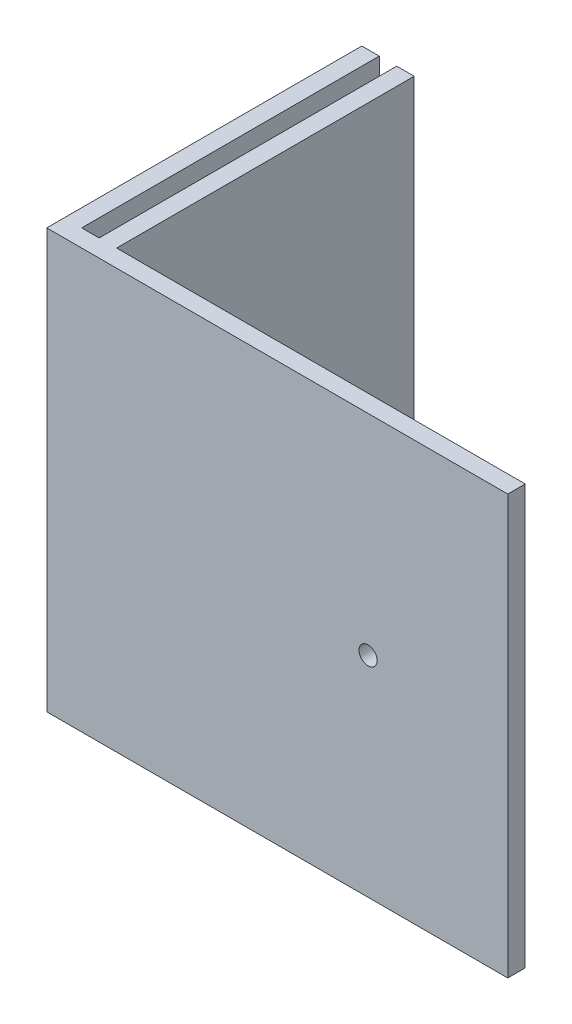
SolidWorks part; units mm, degrees
ref_plane "Front Plane" through (0, 0, 0) normal (0, 0, 1) x (1, 0, 0)
ref_plane "Top Plane" through (0, 0, 0) normal (0, 1, 0) x (1, 0, 0)
ref_plane "Right Plane" through (0, 0, 0) normal (1, 0, 0) x (0, 0, -1)
sketch "Sketch1" plane through (0, 0, 0) normal (0, 0, 1) x (1, 0, 0)
  line L0 (0, 0) -> (0, 76.2)
  line L1 (0, 76.2) -> (-83.82, 76.2)
  line L2 (-83.82, 76.2) -> (-83.82, 0)
  line L3 (-83.82, 0) -> (0, 0)
  circle A0 centre (-25.4, 38.1) radius 1.651
extrude "Boss-Extrude1" add sketch "Sketch1" along normal blind 3.175
sketch "Sketch2" plane through (0, 0, 3.175) normal (0, 0, 1) x (1, 0, 0)
  line L0 (-83.82, 76.2) -> (-80.645, 76.2)
  line L1 (0, 76.2) -> (-83.82, 76.2) construction
  line L2 (-83.82, 76.2) -> (-83.82, 0)
  line L3 (-83.82, 0) -> (-80.645, 0)
  line L4 (-77.47, 0) -> (-74.295, 0)
  line L6 (-83.82, 0) -> (0, 0) construction
  line L7 (-77.47, 76.2) -> (-74.295, 76.2)
  line L8 (-74.295, 0) -> (-74.295, 76.2)
  line L9 (-80.645, 76.2) -> (-80.645, 0)
  line L11 (-77.47, 0) -> (-77.47, 76.2)
extrude "Boss-Extrude2" add sketch "Sketch2" against normal blind 57.277
